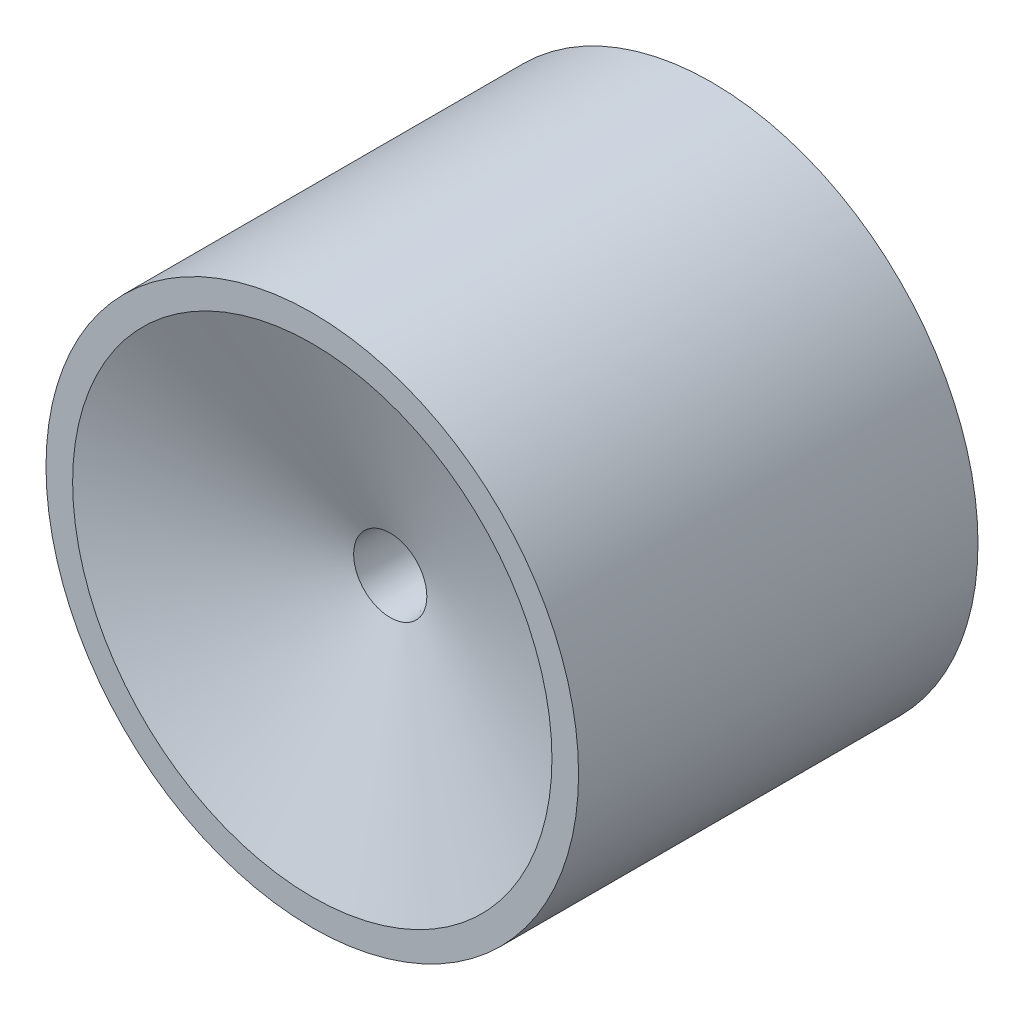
SolidWorks part; units mm, degrees
ref_plane "Plan de face" through (0, 0, 0) normal (0, 0, 1) x (1, 0, 0)
ref_plane "Plan de dessus" through (0, 0, 0) normal (0, 1, 0) x (1, 0, 0)
ref_plane "Plan de droite" through (0, 0, 0) normal (1, 0, 0) x (0, 0, -1)
sketch "Esquisse1" plane through (0, 0, 0) normal (0, 0, 1) x (1, 0, 0)
  circle A0 centre (0, 0) radius 10
  dimension "D1" = 20
extrude "Boss.-Extru.1" add sketch "Esquisse1" along normal blind 15
sketch "Esquisse2" plane through (0, 0, 0) normal (0, 0, 1) x (1, 0, 0)
  circle A0 centre (0, 0) radius 3.4
  dimension "D1" = 6.8
extrude "Enlèv. mat.-Extru.1" cut sketch "Esquisse2" along normal blind 8
sketch "Esquisse3" plane through (0, 0, 8) normal (0, 0, -1) x (-1, 0, 0)
  circle A0 centre (0, 0) radius 1.2
  dimension "D1" = 2.4
extrude "Enlèv. mat.-Extru.2" cut sketch "Esquisse3" against normal through all draft 2.45
sketch "Esquisse5" plane through (0, 0, 15) normal (0, 0, 1) x (1, 0, 0)
  circle A0 centre (0, 0) radius 9
  dimension "D1" = 18
extrude "Enlèv. mat.-Extru.3" cut sketch "Esquisse5" against normal blind 3 draft 69
sketch "Esquisse6" plane through (0, 0, 0) normal (0, 0, -1) x (-1, 0, 0)
  circle A0 centre (0, 0) radius 9
  circle A1 centre (0, 0) radius 5.5
  dimension "D1" = 18
  dimension "D2" = 11
extrude "Enlèv. mat.-Extru.4" cut sketch "Esquisse6" against normal blind 13
